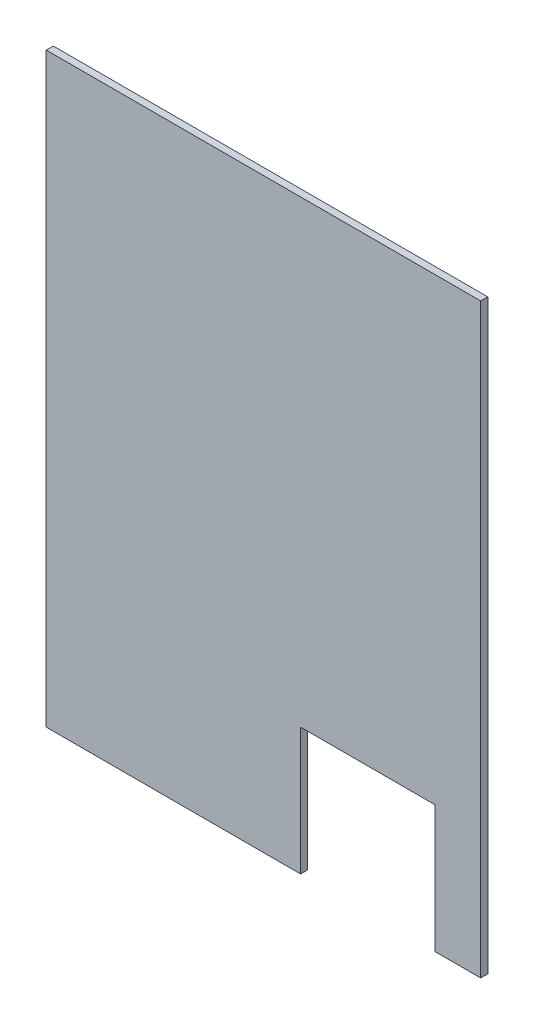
SolidWorks part; units mm, degrees
ref_plane "Plan de face" through (0, 0, 0) normal (0, 0, 1) x (1, 0, 0)
ref_plane "Plan de dessus" through (0, 0, 0) normal (0, 1, 0) x (1, 0, 0)
ref_plane "Plan de droite" through (0, 0, 0) normal (1, 0, 0) x (0, 0, -1)
sketch "Esquisse1" plane through (0, 0, 0) normal (0, 0, 1) x (1, 0, 0)
  line L0 (0, 0) -> (360, 0)
  line L1 (360, 0) -> (360, 180)
  line L2 (0, 0) -> (0, 830)
  line L3 (0, 830) -> (615, 830)
  line L4 (615, 0) -> (615, 830)
  line L5 (360, 180) -> (550, 180)
  line L6 (550, 180) -> (550, 0)
  line L7 (550, 0) -> (615, 0)
  dimension "D1" = 615
  dimension "D2" = 830
  dimension "D3" = 360
  dimension "D4" = 180
  dimension "D5" = 190
extrude "Extrusion1" add sketch "Esquisse1" along normal blind 10
